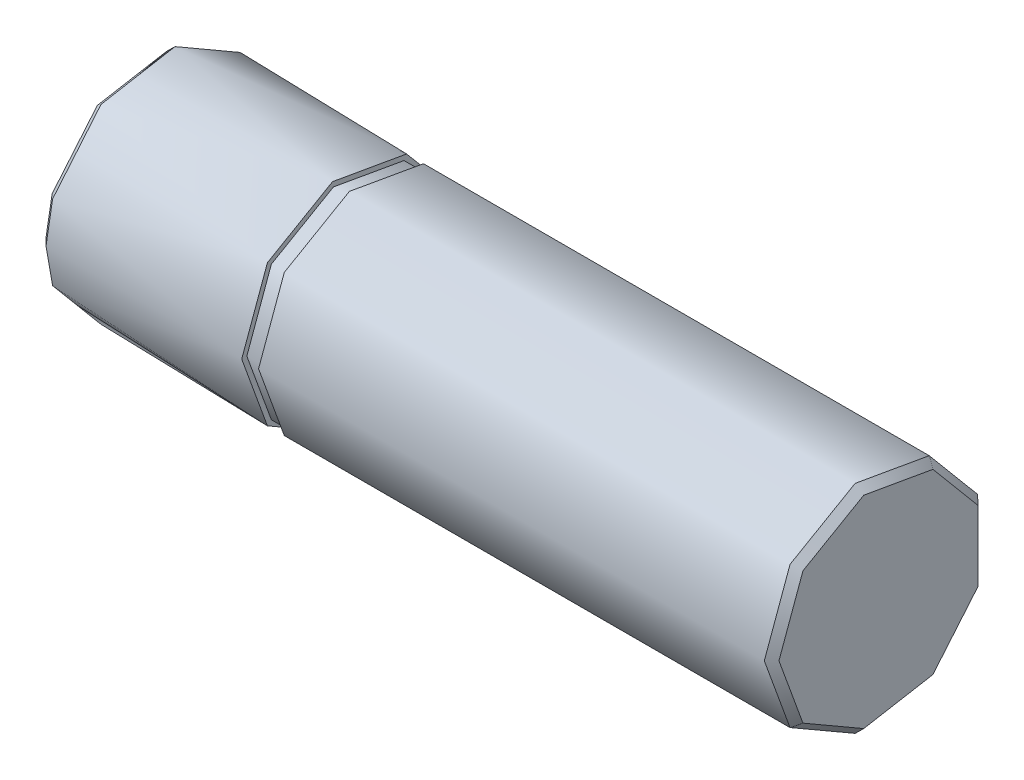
SolidWorks part; units mm, degrees
ref_plane "Front X-Y" through (0, 0, 0) normal (0, 0, 1) x (1, 0, 0)
ref_plane "Top X-Z" through (0, 0, 0) normal (0, 1, 0) x (1, 0, 0)
ref_plane "Right Y-Z" through (0, 0, 0) normal (1, 0, 0) x (0, 0, -1)
ref_plane "Plane1" through (0, 0, 0) normal (0, 0, 1) x (1, 0, 0)
sketch "Sketch1" plane through (0, 0, 0) normal (0, 0, 1) x (1, 0, 0)
  line L0 (0, 0) -> (0, 7)
  line L1 (0, 7) -> (0.5, 7.5)
  line L2 (0.5, 7.5) -> (49.5, 7.5)
  line L3 (49.5, 7.5) -> (50, 7)
  line L4 (50, 7) -> (50, 0)
  line L5 (50, 0) -> (0, 0)
  line L6 (50, 0) -> (0, 0) construction
revolve "Revolve1" add sketch "Sketch1" angle 360 about L6
ref_plane "Plane2" through (0, 0, 0) normal (0, 0, 1) x (1, 0, 0)
sketch "Sketch2" plane through (0, 0, 0) normal (0, 0, 1) x (1, 0, 0)
  line L0 (13.85, 7.15) -> (15, 7.15)
  line L1 (15, 7.15) -> (15, 14.3)
  line L2 (15, 14.3) -> (13.85, 14.3)
  line L3 (13.85, 14.3) -> (13.85, 7.15)
  line L4 (50, 0) -> (-50, 0) construction
  line L5 (0, 7) -> (0, -7) construction
  dimension "D1" = 15
revolve "Cut-Revolve1" cut sketch "Sketch2" angle 360 about L4
ref_plane "Plane3" through (0, 0, 0) normal (0, 0, 1) x (1, 0, 0)
sketch "Sketch3" plane through (0, 0, 0) normal (0, 0, 1) x (1, 0, 0)
  line L0 (35, 7.15) -> (36.15, 7.15)
  line L1 (36.15, 7.15) -> (36.15, 14.3)
  line L2 (36.15, 14.3) -> (35, 14.3)
  line L3 (35, 14.3) -> (35, 7.15)
  line L4 (50, 0) -> (-50, 0) construction
revolve "Cut-Revolve2" [suppressed] cut sketch "Sketch3" angle 360 about L4
